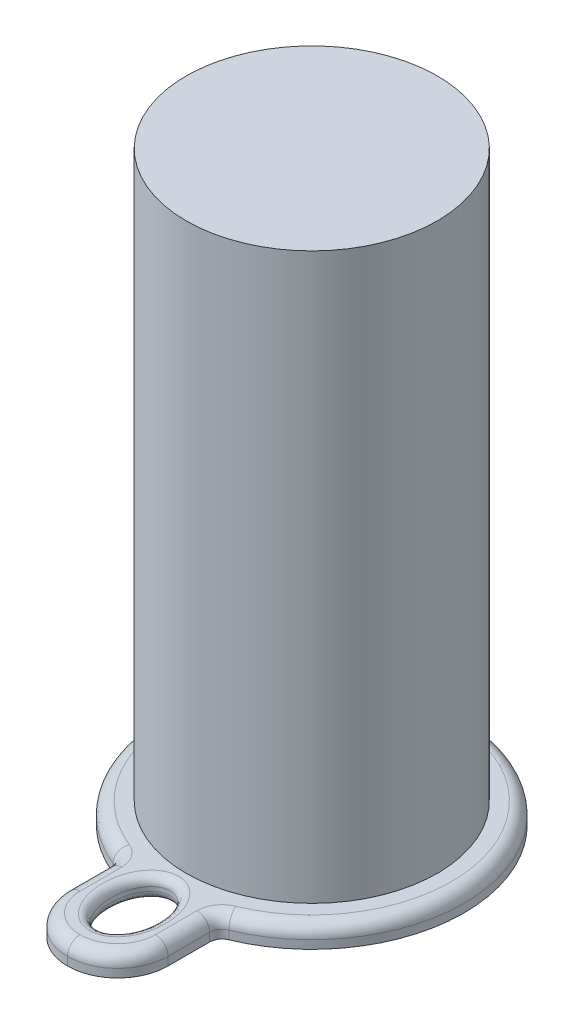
SolidWorks part; units mm, degrees
ref_plane "Front Plane" through (0, 0, 0) normal (0, 0, 1) x (1, 0, 0)
ref_plane "Top Plane" through (0, 0, 0) normal (0, 1, 0) x (1, 0, 0)
ref_plane "Right Plane" through (0, 0, 0) normal (1, 0, 0) x (0, 0, -1)
sketch "Sketch1" plane through (0, 0, 0) normal (0, 1, 0) x (1, 0, 0)
  circle A0 centre (0, 0) radius 38.1
extrude "Boss-Extrude1" add sketch "Sketch1" along normal blind 177.8
sketch "Sketch4" plane through (0, 0, 0) normal (0, 1, 0) x (1, 0, 0)
  line L2 (-15.24, -43.6308) -> (-15.24, -74.1108)
  line L3 (-15.24, -74.1108) -> (15.24, -74.1108)
  line L4 (15.24, -43.6308) -> (15.24, -74.1108)
  arc A0 (15.24, -43.6308) -> (-15.24, -43.6308) centre (0, 0) ccw
  point P7 (0, 0)
  point P8 (0, 0)
  point P9 (0, 0)
extrude "Boss-Extrude2" add sketch "Sketch4" along normal blind 6.35
sketch "Sketch3" plane through (0, 0, 0) normal (0, -1, 0) x (1, 0, 0)
  circle A0 centre (0, 0) radius 33.02
extrude "Cut-Extrude1" cut sketch "Sketch3" against normal blind 172.72
fillet "Fillet1" radius 3.81 7 edges at (0, 6.35, -46.2159) (15.24, 3.175, 43.6308) (0, 6.35, 74.1108) (15.24, 6.35, 58.8708) (-15.24, 3.175, 43.6308) (-15.24, 6.35, 58.8708) (0, 0, -33.02)
fillet "Fillet3" radius 15.24 4 edges at (-14.1241, 5.2341, 72.9949) (14.1241, 5.2341, 72.9949) (15.24, 1.27, 74.1108) (-15.24, 1.27, 74.1108)
sketch "Sketch5" plane through (0, 6.35, 0) normal (0, 1, 0) x (1, 0, 0)
  ellipse E0 centre (0, -53.9101) end of major axis (0.6734, -65.2581) minor radius 7.5164
extrude "Cut-Extrude2" cut sketch "Sketch5" against normal through all
fillet "Fillet4" radius 2.54 2 edges at (0.6734, 6.35, 65.2581) (0.6734, 0, 65.2581)
ref_plane "Plane1" through (0, 0, -38.1) normal (0, 0, -1) x (-1, 0, 0)
sketch "Sketch6" plane through (0, 0, -38.1) normal (0, 0, -1) x (-1, 0, 0)
  line L1 (-6.35, 9.7088) -> (6.35, 9.7088)
  line L2 (-6.35, 9.7088) -> (-6.35, 6.35)
  line L3 (-6.35, 6.35) -> (6.35, 6.35)
  line L4 (6.35, 9.7088) -> (6.35, 6.35)
extrude "Cut-Extrude3" cut sketch "Sketch6" against normal blind 2.54
pattern_linear "LPattern1" count 27 spacing 6.35 along (0, 1, 0) of "Cut-Extrude3"
